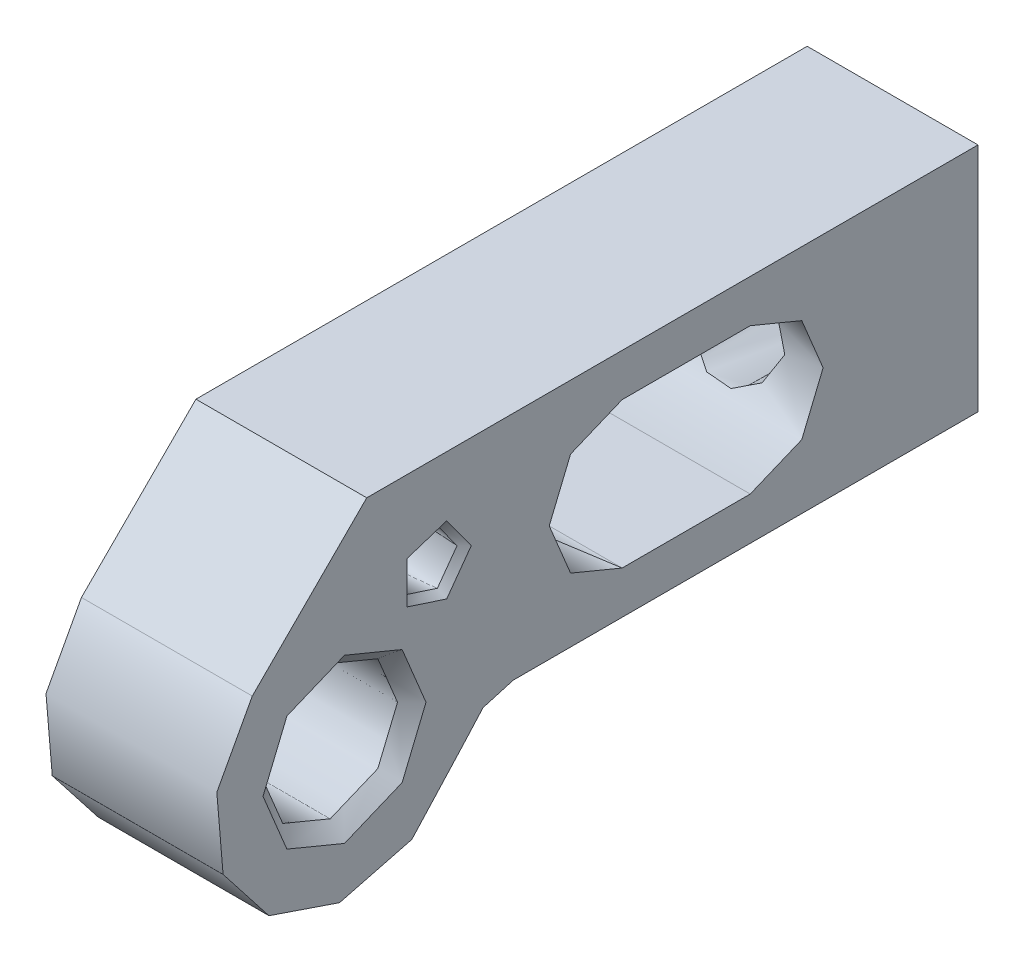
SolidWorks part; units mm, degrees
ref_plane "Front Plane" through (0, 0, 0) normal (0, 0, 1) x (1, 0, 0)
ref_plane "Top Plane" through (0, 0, 0) normal (0, 1, 0) x (1, 0, 0)
ref_plane "Right Plane" through (0, 0, 0) normal (1, 0, 0) x (0, 0, -1)
sketch "Sketch1" plane through (0, 0, 0) normal (1, 0, 0) x (0, 0, -1)
  line L0 (0, 0) -> (-15.875, 0) construction
  line L1 (-15.875, 19.1127) -> (70.6438, 19.1127)
  line L2 (-15.875, 19.1127) -> (-15.875, -19.1127)
  line L3 (-15.875, -19.1127) -> (70.6438, -19.1127)
  line L4 (70.6438, 19.1127) -> (70.6438, -19.1127)
  line L5 (30.9563, 6.2222) -> (45.2437, 6.2222) construction
  line L6 (30.9563, 14.3502) -> (45.2437, 14.3502)
  line L7 (30.9563, -1.9058) -> (45.2438, -1.9058)
  circle A0 centre (0, -3.9378) radius 7.5
  arc A1 (30.9563, 14.3502) -> (30.9563, -1.9058) centre (30.9563, 6.2222) ccw
  arc A2 (45.2438, -1.9058) -> (45.2437, 14.3502) centre (45.2437, 6.2222) ccw
  point P10 (38.1, 6.2222)
  dimension "D1" = 15.875
  dimension "D2" = 15
  dimension "D4" = 16.256
  dimension "D6" = 25.4
  dimension "D8" = 15.175
  dimension "D3" = 10.16
  dimension "D5" = 14.2875
  dimension "D7" = 38.1
  dimension "D9" = 4.7625
extrude "Boss-Extrude1" add sketch "Sketch1" along normal mid plane 19.05
sketch "Sketch4" plane through (9.525, 0, 0) normal (1, 0, 0) x (0, 0, -1)
  line L0 (30.9563, -1.9058) -> (45.2438, -1.9058) construction
  line L1 (70.6438, -19.1127) -> (14.2875, -19.1127)
  line L2 (70.6438, -19.1127) -> (70.6438, -6.6683)
  line L3 (70.6438, -6.6683) -> (14.2875, -6.6683)
  line L4 (14.2875, -19.1127) -> (14.2875, -6.6683)
  circle A0 centre (0, -3.9378) radius 7.5 construction
  dimension "D1" = 4.7625
  dimension "D2" = 14.2875
extrude "Cut-Extrude1" cut sketch "Sketch4" against normal through all
sketch "Sketch5" plane through (9.525, 0, 0) normal (1, 0, 0) x (0, 0, -1)
  line L0 (-15.875, -19.1127) -> (14.2875, -19.1127) construction
  line L1 (14.2875, -0.3183) -> (23.8125, -0.3183)
  line L2 (14.2875, -0.3183) -> (14.2875, -19.1127)
  line L3 (14.2875, -19.1127) -> (23.8125, -19.1127)
  line L4 (23.8125, -0.3183) -> (23.8125, -19.1127)
  line L5 (14.2875, -6.6683) -> (14.2875, -19.1127) construction
  line L6 (70.6438, -6.6683) -> (14.2875, -6.6683) construction
  dimension "D1" = 9.525
  dimension "D2" = 6.35
extrude "Cut-Extrude2" [suppressed] cut sketch "Sketch5" against normal through all
fillet "Fillet1" [suppressed] radius 3.175
chamfer "Chamfer1" [suppressed] distance 6.35 angle 45
hole_wizard "1/2-13 Tapped Hole1" positions "Sketch3" profile "Sketch2" tap size "1/2-13" standard "ANSI Inch"
sketch "Sketch3" plane through (0, 0, -70.6438) normal (0, 0, -1) x (-1, 0, 0)
  line L0 (0, -6.6683) -> (0, 19.1127) construction
  line L1 (9.525, -6.6683) -> (-9.525, -6.6683) construction
  line L2 (-9.525, 19.1127) -> (9.525, 19.1127) construction
  point P0 (0, 6.2222)
sketch "Sketch2" plane through (0, 6.2222, -70.6438) normal (1, 0, 0) x (0, 1, 0)
  line L0 (0, 0) -> (0, 17.272)
  line L1 (0, 17.272) -> (5.3581, 17.272)
  line L2 (5.3581, 17.272) -> (5.3581, 0)
  line L5 (5.3581, 0) -> (0, 0)
  line L11 (0, -6.35) -> (0, 107.95) construction
  dimension "Thru Tap Drill Dia." = 10.7163
  dimension "Thru Tap Drill Depth" = 17.272
chamfer "Chamfer2" [suppressed] distance 3.175 angle 45
chamfer "Chamfer3" distance 15.875 angle 45 1 edges at (0, 19.1127, 15.875)
chamfer "Chamfer4" [suppressed] distance 6.35 angle 45
sketch "Sketch6" plane through (9.525, 0, 0) normal (1, 0, 0) x (0, 0, -1)
  line L0 (-10.2856, 6.3479) -> (2.4792, 19.1127)
  line L1 (70.6438, 19.1127) -> (0, 19.1127) construction
  line L2 (0, 19.1127) -> (-15.875, 3.2377) construction
  line L3 (14.2875, -6.6683) -> (14.2875, -19.1127)
  line L4 (14.2875, -19.1127) -> (-15.875, -19.1127)
  line L5 (-15.875, -19.1127) -> (-15.875, 19.1127)
  line L6 (-15.875, 19.1127) -> (2.4792, 19.1127)
  arc A0 (-10.2856, 6.3479) -> (14.2875, -6.6683) centre (0, -3.9378) ccw
extrude "Cut-Extrude3" cut sketch "Sketch6" against normal through all
fillet "Fillet2" radius 6.35 1 edges at (0, -6.6683, -14.2875)
sketch "Sketch7" plane through (9.525, 0, 0) normal (1, 0, 0) x (0, 0, -1)
  line L0 (-15.3818, 9.9442) -> (48.9258, -1.395) construction
  line L1 (10.4775, 0) -> (-10.4775, 0) construction
  line L2 (14.9321, 17.3998) -> (7.8818, -22.5843) construction
  circle A0 centre (0, -3.9378) radius 11 construction
  circle A1 centre (10.1676, 8.6631) radius 3.175
  circle A2 centre (0, -3.9378) radius 7.5 construction
  dimension "D1" = 22
  dimension "D3" = 6.35
  dimension "D4" = 11
  dimension "D2" = 10
extrude "Cut-Extrude4" cut sketch "Sketch7" against normal through all
chamfer "Chamfer5" distance 1.5875 angle 45 2 edges at (-9.525, -3.9378, -7.5) (9.525, -3.9378, -7.5)
chamfer "Chamfer6" distance 0.7937 angle 45 2 edges at (-9.525, 8.6631, -13.3426) (9.525, 8.6631, -13.3426)
